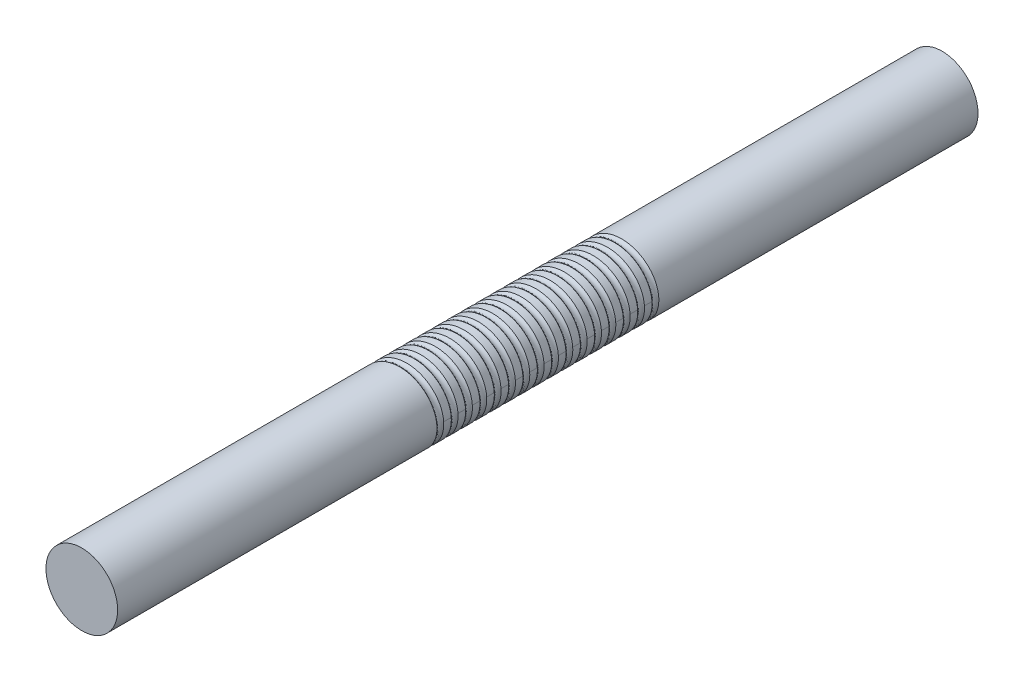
SolidWorks part; units mm, degrees
ref_plane "Front Plane" through (0, 0, 0) normal (0, 0, 1) x (1, 0, 0)
ref_plane "Top Plane" through (0, 0, 0) normal (0, 1, 0) x (1, 0, 0)
ref_plane "Right Plane" through (0, 0, 0) normal (1, 0, 0) x (0, 0, -1)
sketch "Sketch1" plane through (0, 0, 0) normal (0, 0, 1) x (1, 0, 0)
  circle A0 centre (0, 0) radius 25
  dimension "D1" = 50
extrude "Boss-Extrude1" add sketch "Sketch1" along normal blind 600
ref_plane "Plane1" through (0, 0, 220) normal (0, 0, 1) x (1, 0, 0)
sketch "Sketch2" plane through (0, 0, 220) normal (0, 0, 1) x (1, 0, 0)
  circle A0 centre (0, 0) radius 27.1167
  dimension "D1" = 54.2333
curve "Helix/Spiral1"
sketch "Sketch3" plane through (0, 0, 0) normal (0, 1, 0) x (1, 0, 0)
  circle A0 centre (-27.1167, -220) radius 3.175
  spline S0 degree 3 number of poles 372 (-27.1167, -220) -> (-27.1167, -380) construction
  dimension "D1" = 6.35
sweep "Cut-Sweep1" cut profiles "Sketch3" path "Helix/Spiral1"
pattern_linear "LPattern1" [suppressed] count 2 spacing 500
